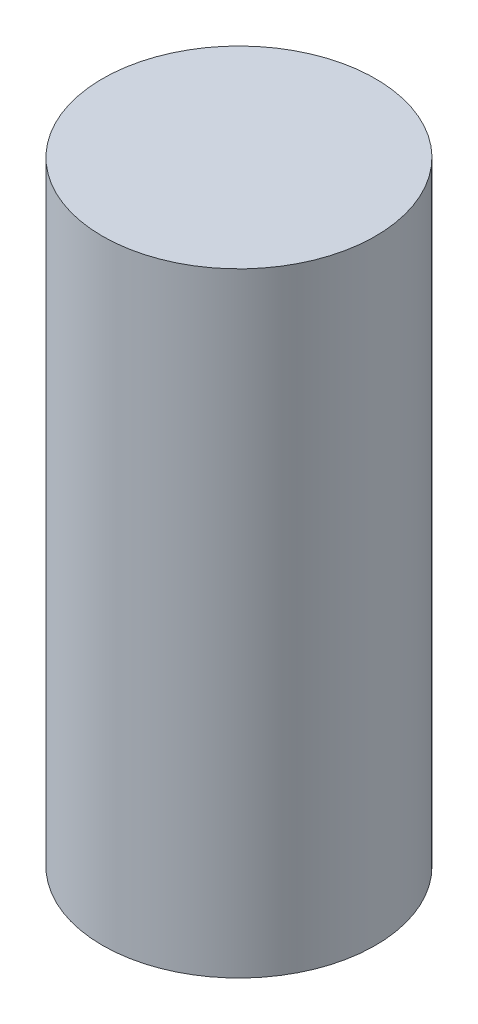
SolidWorks part; units mm, degrees
ref_plane "Front Plane" through (0, 0, 0) normal (0, 0, 1) x (1, 0, 0)
ref_plane "Top Plane" through (0, 0, 0) normal (0, 1, 0) x (1, 0, 0)
ref_plane "Right Plane" through (0, 0, 0) normal (1, 0, 0) x (0, 0, -1)
sketch "Sketch1" plane through (0, 0, 0) normal (0, 1, 0) x (1, 0, 0)
  circle A0 centre (0, 0) radius 1
  dimension "D1" = 2
extrude "Boss-Extrude1" add sketch "Sketch1" along normal blind 4.5
